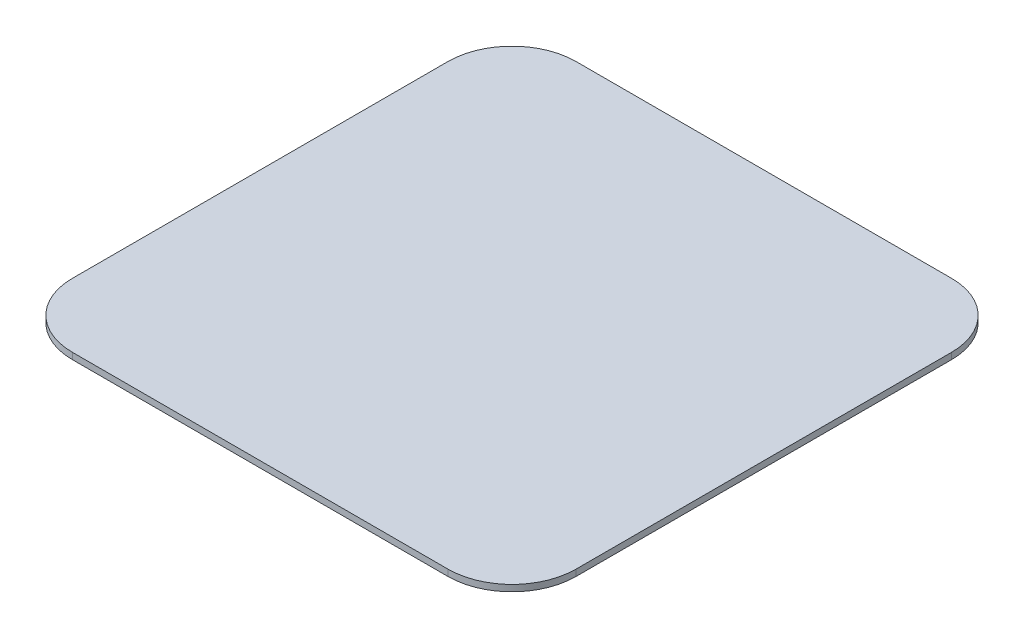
SolidWorks part; units mm, degrees
ref_plane "Front Plane" through (0, 0, 0) normal (0, 0, 1) x (1, 0, 0)
ref_plane "Top Plane" through (0, 0, 0) normal (0, 1, 0) x (1, 0, 0)
ref_plane "Right Plane" through (0, 0, 0) normal (1, 0, 0) x (0, 0, -1)
sketch "Sketch1" plane through (0, 0, 0) normal (0, 1, 0) x (1, 0, 0)
  line L1 (0, 0) -> (2000, 0)
  line L2 (0, 0) -> (0, 2000)
  line L3 (0, 2000) -> (2000, 2000)
  line L4 (2000, 0) -> (2000, 2000)
  dimension "D1" = 2000
  dimension "D2" = 2000
extrude "Extrude1" add sketch "Sketch1" along normal blind 25.4
fillet "Fillet1" radius 254 4 edges at (0, 12.7, -2000) (2000, 12.7, -2000) (2000, 12.7, 0) (0, 12.7, 0)
sketch "Sketch2" plane through (0, 0, 0) normal (0, -1, 0) x (1, 0, 0)
  line L0 (0, -1051.6337) -> (2000, -1051.6337)
  line L1 (0, -1746) -> (0, -254) construction
  line L2 (2000, -254) -> (2000, -1746) construction
sketch "Sketch3" [suppressed] plane through (0, 0, 0) normal (0, -1, 0) x (1, 0, 0)
  line L0 (0, -871.6337) -> (2000, -871.6337)
  line L1 (0, -1051.6337) -> (0, -254) construction
  line L2 (2000, -254) -> (2000, -1051.6337) construction
  line L3 (2000, -1051.6337) -> (0, -1051.6337) construction
  dimension "D1" = 180
